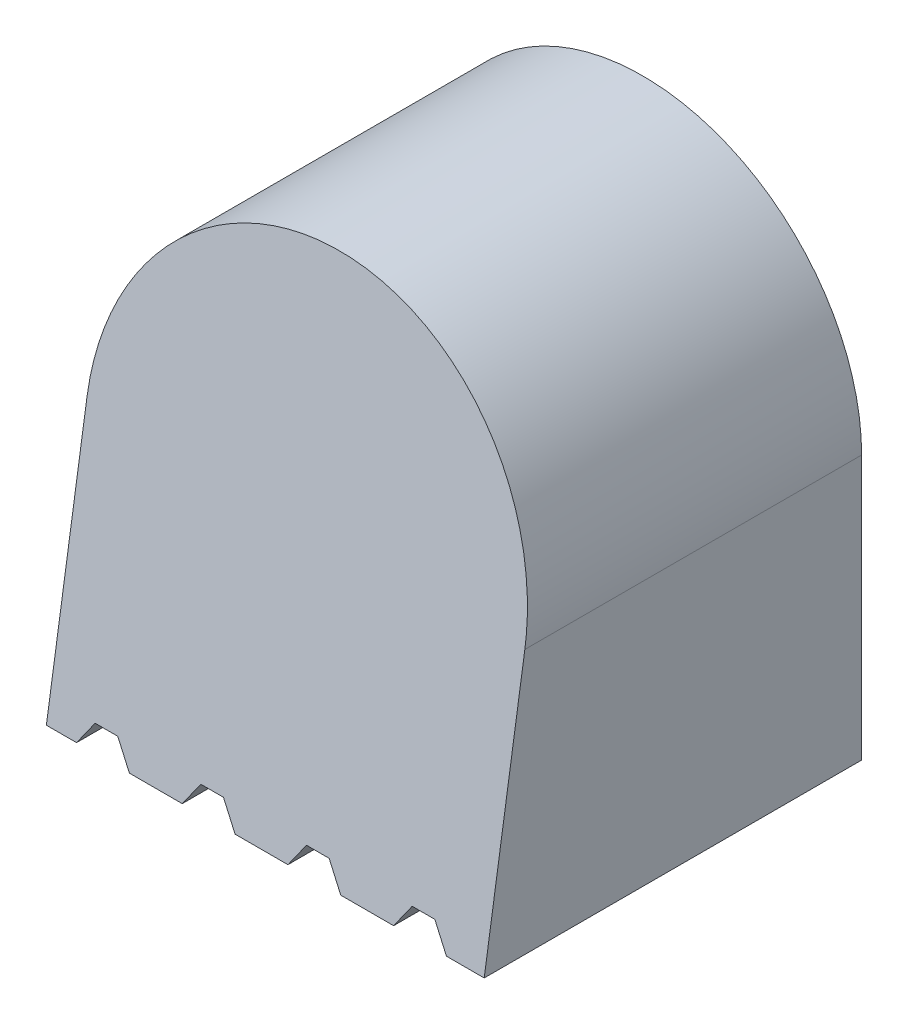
SolidWorks part; units mm, degrees
ref_plane "Plan1" through (0, 0, 0) normal (0, 0, 1) x (1, 0, 0)
ref_plane "Plan2" through (0, 0, 0) normal (0, 1, 0) x (1, 0, 0)
ref_plane "Plan3" through (0, 0, 0) normal (1, 0, 0) x (0, 0, -1)
sketch "Esquisse1" plane through (0, 0, 0) normal (0, 0, 1) x (1, 0, 0)
  line L0 (0, 0) -> (58, 0)
  line L1 (58, 0) -> (58, 35)
  line L2 (0, 0) -> (0, 35)
  arc A0 (0, 35) -> (58, 35) centre (29, 35) cw
  dimension "D1" = 35
  dimension "D2" = 29
extrude "Base-Extrusion" add sketch "Esquisse1" along normal blind 50
sketch "Esquisse2" plane through (58, 0, 0) normal (1, 0, 0) x (0, 0, -1)
  line L0 (-50, 0) -> (-40, 65)
  line L1 (-40, 65) -> (-55, 65)
  line L2 (-55, 65) -> (-55, 0)
  line L3 (-55, 0) -> (-50, 0)
extrude "Enlèv. mat.-Extru.1" cut sketch "Esquisse2" against normal through all
sketch "Esquisse3" plane through (0, 0, 0) normal (0, 0, -1) x (-1, 0, 0)
  line L0 (-53, 0) -> (-51, 3)
  line L1 (0, 0) -> (-58, 0) construction
  line L2 (-51, 3) -> (-48, 3)
  line L3 (-49.5, 7) -> (-49.5, -1) construction
  line L4 (-46, 0) -> (-48, 3)
  line L5 (-53, 0) -> (-46, 0)
  line L6 (-39, 0) -> (-32, 0)
  line L7 (-39, 0) -> (-37, 3)
  line L8 (-37, 3) -> (-34, 3)
  line L9 (-32, 0) -> (-34, 3)
  line L10 (-25, 0) -> (-18, 0)
  line L11 (-25, 0) -> (-23, 3)
  line L12 (-23, 3) -> (-20, 3)
  line L13 (-18, 0) -> (-20, 3)
  line L14 (-11, 0) -> (-4, 0)
  line L15 (-11, 0) -> (-9, 3)
  line L16 (-9, 3) -> (-6, 3)
  line L17 (-4, 0) -> (-6, 3)
  point P9 (-49.5, 3)
  dimension "D1" = 3
  dimension "D2" = 3
extrude "Enlèv. mat.-Extru.2" cut sketch "Esquisse3" against normal through all
sketch "Esquisse4" plane through (0, 0, 0) normal (0, 0, -1) x (-1, 0, 0)
  circle A0 centre (-29, 35) radius 25.5
  dimension "D1" = 51
extrude "Enlèv. mat.-Extru.3" cut sketch "Esquisse4" against normal blind 35
sketch "Esquisse5" plane through (0, 0, 0) normal (0, 0, -1) x (-1, 0, 0)
  line L0 (-51.1077, 19.5) -> (-54.901, 19.5)
  line L1 (-54.901, 19.5) -> (-54.901, 5.5)
  line L2 (-54.901, 5.5) -> (-49.901, 5.5)
  line L3 (-49.901, 5.5) -> (-49.901, 17.9076)
  line L4 (-45.901, 13.9439) -> (-45.901, 5.5)
  line L5 (-45.901, 5.5) -> (-40.901, 5.5)
  line L6 (-40.901, 5.5) -> (-40.901, 10.7643)
  line L7 (-29, 5) -> (-29, 53) construction
  line L8 (-53, 0) -> (-58, 0) construction
  line L9 (-3.099, 5.5) -> (-8.099, 5.5)
  line L10 (-3.099, 19.5) -> (-3.099, 5.5)
  line L11 (-6.8923, 19.5) -> (-3.099, 19.5)
  line L12 (-8.099, 5.5) -> (-8.099, 17.9076)
  line L13 (-17.099, 5.5) -> (-17.099, 10.7643)
  line L14 (-12.099, 5.5) -> (-17.099, 5.5)
  line L15 (-12.099, 13.9439) -> (-12.099, 5.5)
  arc A0 (-51.1077, 19.5) -> (-49.901, 17.9076) centre (-29, 35) ccw
  arc A1 (-45.901, 13.9439) -> (-40.901, 10.7643) centre (-29, 35) ccw
  arc A2 (-6.8923, 19.5) -> (-8.099, 17.9076) centre (-29, 35) cw
  arc A3 (-12.099, 13.9439) -> (-17.099, 10.7643) centre (-29, 35) cw
  dimension "D6" = 54
  dimension "D1" = 14
  dimension "D2" = 5
  dimension "D3" = 4
  dimension "D4" = 5
  dimension "D5" = 5.5
extrude "Enlèv. mat.-Extru.4" cut sketch "Esquisse5" against normal blind 43
